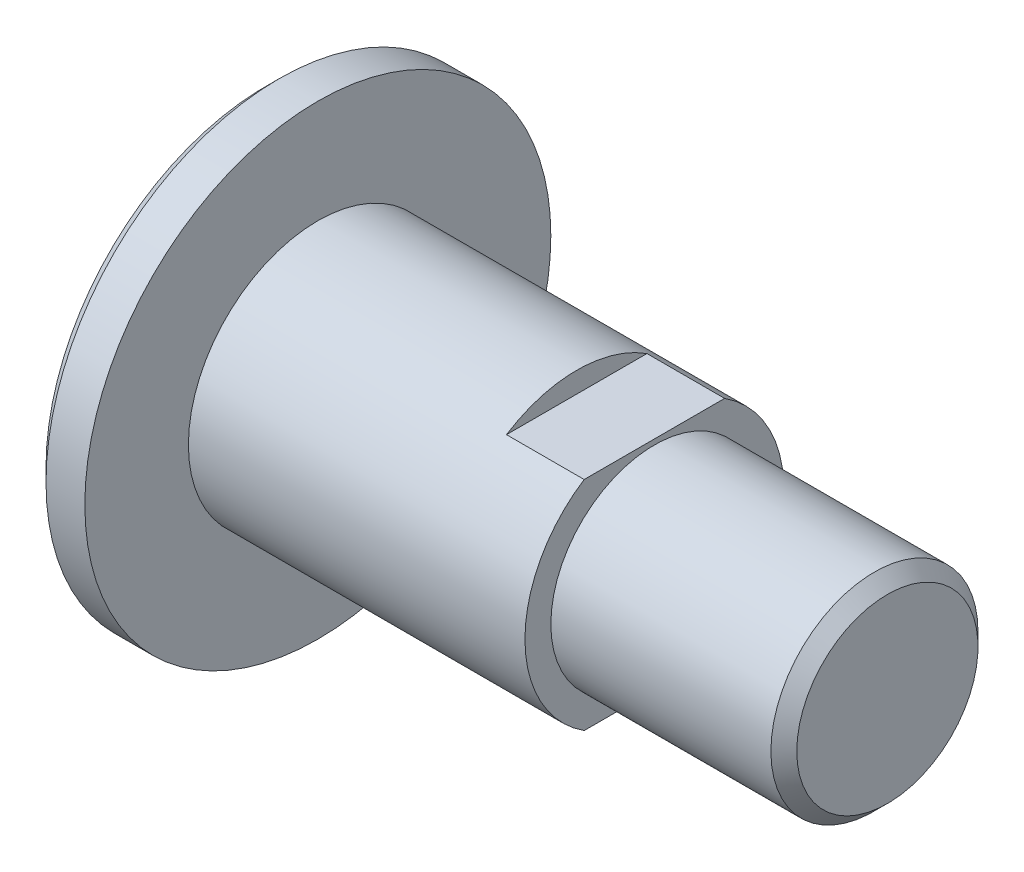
SolidWorks part; units mm, degrees
ref_plane "Plane1" through (0, 0, 0) normal (0, 0, 1) x (1, 0, 0)
ref_plane "Plane2" through (0, 0, 0) normal (0, 1, 0) x (1, 0, 0)
ref_plane "Plane3" through (0, 0, 0) normal (1, 0, 0) x (0, 0, -1)
sketch "Esquisse1" plane through (0, 0, 0) normal (0, 0, 1) x (1, 0, 0)
  line L0 (0, 0) -> (0, 8.5)
  line L1 (0, 8.5) -> (0.5, 9)
  line L2 (0.5, 9) -> (2, 9)
  line L3 (2, 9) -> (2, 5)
  line L4 (2, 5) -> (15, 5)
  line L5 (15, 5) -> (15, 4)
  line L6 (15, 4) -> (23.5, 4)
  line L7 (23.5, 4) -> (24, 3.5)
  line L8 (24, 3.5) -> (24, 0)
  line L9 (24, 0) -> (0, 0)
  line L10 (-3, 0) -> (-1, 0) construction
revolve "Base-Révolution" add sketch "Esquisse1" angle 360 about L10
sketch "Esquisse2" plane through (0, 0, 0) normal (0, 0, 1) x (1, 0, 0)
  line L0 (12, 5.5) -> (16, 5.5)
  line L1 (12, 5.5) -> (12, 4.2)
  line L2 (16, 4.2) -> (12, 4.2)
  line L3 (16, 4.2) -> (16, 5.5)
  line L4 (12.6, 0) -> (13.7, 0) construction
  line L5 (16, -4.2) -> (16, -5.5)
  line L6 (16, -4.2) -> (12, -4.2)
  line L7 (12, -5.5) -> (12, -4.2)
  line L9 (12, -5.5) -> (16, -5.5)
  dimension "D1" = 4.2
extrude "Enlèv. mat.-Extru.1" cut sketch "Esquisse2" against normal mid plane 22
